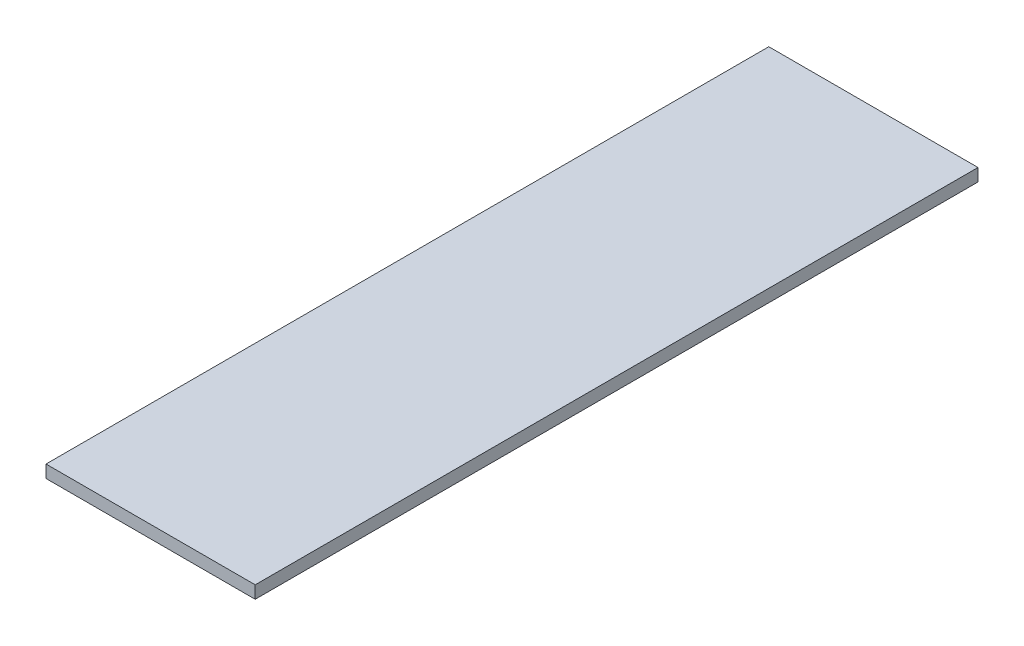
SolidWorks part; units mm, degrees
ref_plane "Front" through (0, 0, 0) normal (0, 0, 1) x (1, 0, 0)
ref_plane "Top" through (0, 0, 0) normal (0, 1, 0) x (1, 0, 0)
ref_plane "Right" through (0, 0, 0) normal (1, 0, 0) x (0, 0, -1)
sketch "Sketch1" plane through (0, 0, 0) normal (0, 1, 0) x (1, 0, 0)
  line L1 (-100, -345.5) -> (100, -345.5)
  line L2 (-100, -345.5) -> (-100, 345.5)
  line L3 (-100, 345.5) -> (100, 345.5)
  line L4 (100, -345.5) -> (100, 345.5)
  line L5 (-100, -345.5) -> (100, 345.5) construction
  line L6 (-100, 345.5) -> (100, -345.5) construction
  point P0 (0, 0)
  dimension "D1" = 691
  dimension "D2" = 200
extrude "Boss-Extrude1" add sketch "Sketch1" along normal blind 12
